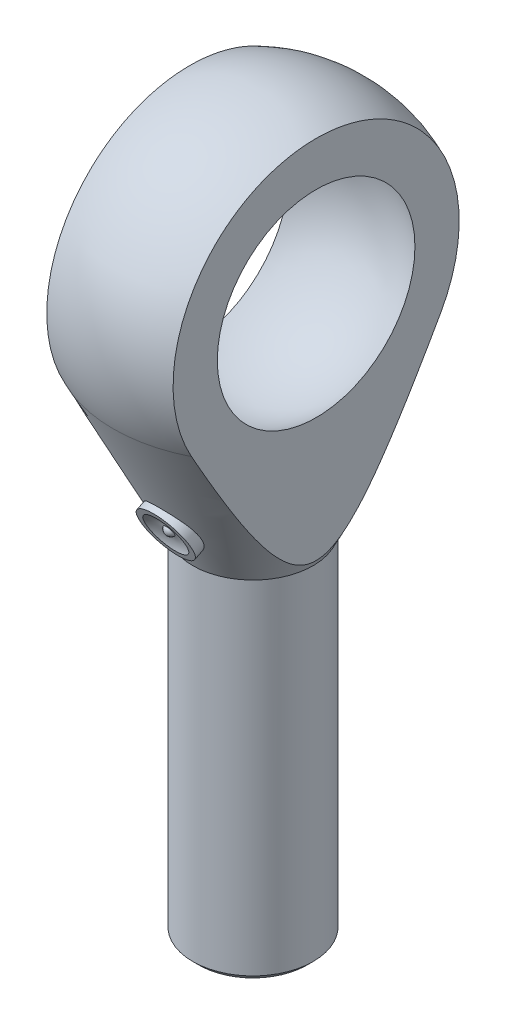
SolidWorks part; units mm, degrees
ref_plane "Plan1" through (0, 0, 0) normal (0, 0, 1) x (1, 0, 0)
ref_plane "Plan2" through (0, 0, 0) normal (0, 1, 0) x (1, 0, 0)
ref_plane "Plan3" through (0, 0, 0) normal (1, 0, 0) x (0, 0, -1)
sketch "Esquisse1" plane through (0, 0, 0) normal (0, 0, 1) x (1, 0, 0)
  line L0 (0, 30.475) -> (0, -68.4613) construction
  line L1 (-5, -48) -> (0, -48)
  line L2 (0, -48) -> (0, 13)
  line L3 (-5, -19) -> (-11.6154, -5.8381)
  line L7 (-5, -19) -> (-5, -48)
  arc A0 (0, 13) -> (-11.6154, -5.8381) centre (0, 0) ccw
  dimension "D1" = 26
  dimension "D4" = 48
  dimension "D2" = 5
  dimension "D3" = 29
  dimension "D5" = 26.685
revolve "Base-Révolution" add sketch "Esquisse1" angle 360 about L0
ref_plane "Plan4" through (5.25, 0, 0) normal (1, 0, 0) x (0, 0, -1)
sketch "Esquisse2" plane through (5.25, 0, 0) normal (1, 0, 0) x (0, 0, -1)
  line L0 (-15.597, 18.0769) -> (18.9361, 18.0769)
  line L1 (-15.597, 18.0769) -> (-15.597, -21.2831)
  line L2 (18.9361, -21.2831) -> (-15.597, -21.2831)
  line L3 (18.9361, -21.2831) -> (18.9361, 18.0769)
extrude "Enlèv. mat.-Extru.1" cut sketch "Esquisse2" along normal through all
mirror "Symétrie1" about plane through (0, 0, 0) normal (1, 0, 0) of "Enlèv. mat.-Extru.1"
sketch "Esquisse3" plane through (0, 0, 0) normal (1, 0, 0) x (0, 0, -1)
  line L0 (0, 14.3677) -> (0, -12.6491) construction
  line L1 (0, 30.475) -> (0, -68.4613) construction
  line L2 (0, 9.75) -> (0, -9.75)
  arc A0 (0, 9.75) -> (0, -9.75) centre (0, 0) ccw
  dimension "D1" = 19.5
revolve "Boss.-Révol.1" add sketch "Esquisse3" angle 360 about L0
ref_plane "Plan5" through (7, 0, 0) normal (1, 0, 0) x (0, 0, -1)
sketch "Esquisse4" plane through (7, 0, 0) normal (1, 0, 0) x (0, 0, -1)
  line L0 (-7.6816, 7.1587) -> (8.7575, 7.1587)
  line L1 (-7.6816, 7.1587) -> (-7.6816, -7.5287)
  line L2 (8.7575, -7.5287) -> (-7.6816, -7.5287)
  line L3 (8.7575, -7.5287) -> (8.7575, 7.1587)
extrude "Enlèv. mat.-Extru.2" cut sketch "Esquisse4" along normal through all
mirror "Symétrie2" about plane through (0, 0, 0) normal (1, 0, 0) of "Enlèv. mat.-Extru.2"
sketch "Esquisse5" plane through (-7, 0, 0) normal (-1, 0, 0) x (0, 0, 1)
  circle A0 centre (0, 0) radius 5
  dimension "D1" = 10
extrude "Enlèv. mat.-Extru.3" cut sketch "Esquisse5" against normal through all
sketch "Esquisse7" plane through (0, 0, 0) normal (1, 0, 0) x (0, 0, -1)
  line L0 (0, 9.75) -> (0, -9.75)
  line L1 (0, -9.75) -> (0, 9.75)
  line L2 (0, -9.75) -> (0, 9.75) construction
  arc A1 (0, 9.75) -> (0, -9.75) centre (0, 0) ccw
  arc A2 (0, 9.75) -> (0, -9.75) centre (0, 0) ccw
  dimension "D1" = 0
revolve "Enlèvement de matière-Révolution1" cut sketch "Esquisse7" angle 360 about L2
chamfer "Chanfrein1" distance 0.5 angle 45 1 edges at (0, -48, 5)
sketch "Esquisse6" plane through (0, 0, 0) normal (1, 0, 0) x (0, 0, -1)
  line L0 (-6.8004, -15.418) -> (0, -12) construction
  line L1 (-5.4601, -14.7443) -> (-6.4706, -12.734)
  line L2 (-11.6154, -5.8381) -> (-5, -19) construction
  line L3 (-6.4706, -12.734) -> (-8.2576, -13.6322)
  line L4 (-8.2576, -13.6322) -> (-8.033, -14.0789)
  line L5 (-7.2471, -15.6425) -> (-5.4601, -14.7443)
  arc A0 (-7.1849, -15.0983) -> (-7.2471, -15.6425) centre (-6.8004, -15.418) ccw
  arc A1 (-8.033, -14.0789) -> (-7.1849, -15.0983) centre (-9.0595, -15.7954) cw
  dimension "D5" = 0.5
  dimension "D3" = 2
  dimension "D1" = 12
  dimension "D2" = 4.5
  dimension "D4" = 0.5
  dimension "D6" = 3.5
  dimension "D7" = 0.3
  dimension "D8" = 1.5
revolve "Boss.-Révol.2" add sketch "Esquisse6" angle 360 about L0
